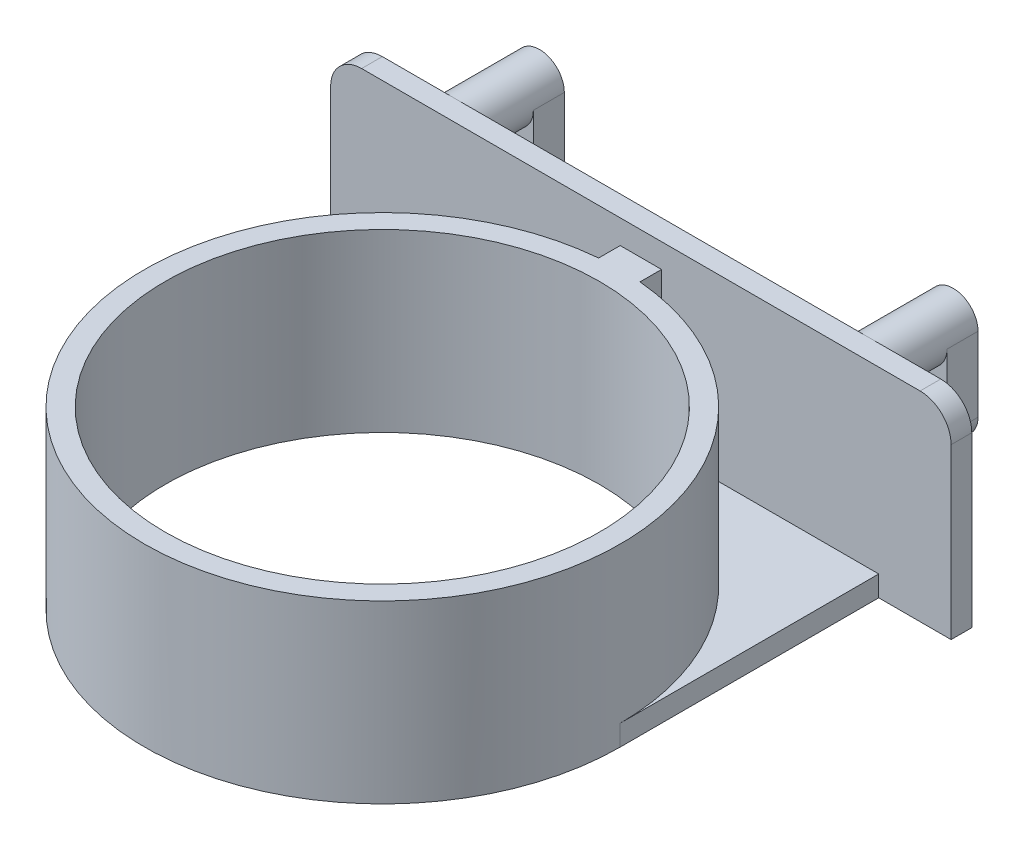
SolidWorks part; units mm, degrees
ref_plane "Ön Düzlem" through (0, 0, 0) normal (0, 0, 1) x (1, 0, 0)
ref_plane "Üst Düzlem" through (0, 0, 0) normal (0, 1, 0) x (1, 0, 0)
ref_plane "Sağ Düzlem" through (0, 0, 0) normal (1, 0, 0) x (0, 0, -1)
sketch "Çizim1" plane through (0, 0, 0) normal (0, 1, 0) x (1, 0, 0)
  circle A0 centre (0, 0) radius 21
  circle A1 centre (0, 0) radius 23
  dimension "D1" = 42
  dimension "D2" = 2
extrude "Yükseklik-Ekstrüzyon1" add sketch "Çizim1" along normal blind 15
sketch "Çizim2" plane through (0, 0, 0) normal (0, -1, 0) x (1, 0, 0)
  line L0 (-23, 0) -> (-23, -25)
  line L1 (23, 0) -> (23, -25)
  line L2 (23, -25) -> (-23, -25)
  circle A1 centre (0, 0) radius 23
  arc A2 (23, 0) -> (-23, 0) centre (0, 0) ccw
  dimension "D2" = 25
  dimension "D1" = 0
extrude "Yükseklik-Ekstrüzyon2" add sketch "Çizim2" along normal blind 2
sketch "Çizim3" plane through (0, 0, -25) normal (0, 0, -1) x (-1, 0, 0)
  line L0 (23, -2) -> (-23, -2) construction
  line L2 (30, -2) -> (30, 14.3251)
  line L3 (27, 17.3251) -> (-27, 17.3251)
  line L4 (-30, -2) -> (-30, 14.3251)
  line L5 (0, -2) -> (-30, 17.3251) construction
  line L6 (30, 17.3251) -> (0, -2) construction
  line L7 (-30, -2) -> (30, -2)
  arc A0 (30, 14.3251) -> (27, 17.3251) centre (27, 14.3251) ccw
  arc A1 (-27, 17.3251) -> (-30, 14.3251) centre (-27, 14.3251) ccw
  point P0 (0, -2)
  dimension "D2" = 3
  dimension "D1" = 60
extrude "Yükseklik-Ekstrüzyon3" add sketch "Çizim3" along normal blind 2
sketch "Çizim4" plane through (0, 15, 0) normal (0, 1, 0) x (1, 0, 0)
  line L0 (0, 21.8) -> (0, 27) construction
  line L1 (-27, 27) -> (27, 27) construction
  line L2 (-2, 21.8) -> (-2, 26.8)
  line L3 (2, 21.8) -> (2, 26.8)
  line L4 (-2, 26.8) -> (2, 26.8)
  line L5 (-2, 21.8) -> (2, 21.8)
  point P8 (0, 24)
  dimension "D1" = 4
  dimension "D2" = 5
  dimension "D3" = 5.2
extrude "Yükseklik-Ekstrüzyon4" add sketch "Çizim4" against normal up to surface (15 mm away)
sketch "Çizim5" plane through (0, 0, -27) normal (0, 0, -1) x (-1, 0, 0)
  line L0 (27, 17.3251) -> (-27, 17.3251) construction
  circle A0 centre (-20, 14.9251) radius 2.4
  dimension "D1" = 20
  dimension "D2" = 4.8
extrude "Yükseklik-Ekstrüzyon5" add sketch "Çizim5" along normal blind 5.2
sketch "Çizim6" plane through (0, 0, -32.2) normal (0, 0, -1) x (-1, 0, 0)
  line L0 (-20, 14.9251) -> (-20, 7.7251) construction
  line L1 (-17.6, 14.9251) -> (-17.6, 7.7251)
  line L2 (-22.4, 14.9251) -> (-22.4, 7.7251)
  arc A0 (-17.6, 14.9251) -> (-22.4, 14.9251) centre (-20, 14.9251) ccw
  arc A1 (-22.4, 7.7251) -> (-17.6, 7.7251) centre (-20, 7.7251) ccw
  point P3 (-20, 11.3251)
  point P8 (-20, 5.3251)
  dimension "D1" = 2.4
  dimension "D2" = 12
extrude "Yükseklik-Ekstrüzyon6" add sketch "Çizim6" along normal blind 3
ref_plane "Düzlem1" through (0, 0, 0) normal (1, 0, 0) x (0, 0, -1)
mirror "Aynalama1" about plane through (0, 0, 0) normal (1, 0, 0) of "Yükseklik-Ekstrüzyon6", "Yükseklik-Ekstrüzyon5"
sketch "Çizim7" plane through (0, 0, 0) normal (0, 1, 0) x (1, 0, 0)
  circle A1 centre (0, 0) radius 21
  circle A2 centre (0, 0) radius 21
  dimension "D1" = 0
extrude "Kes-Ekstrüzyon1" cut sketch "Çizim7" against normal up to next
